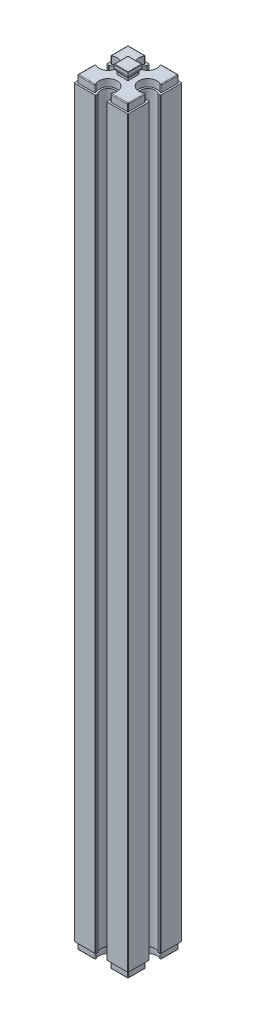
SolidWorks part; units mm, degrees
ref_plane "前视基准面" through (0, 0, 0) normal (0, 0, 1) x (1, 0, 0)
ref_plane "上视基准面" through (0, 0, 0) normal (0, 1, 0) x (1, 0, 0)
ref_plane "右视基准面" through (0, 0, 0) normal (1, 0, 0) x (0, 0, -1)
sketch "草图1" plane through (0, 0, 0) normal (0, 1, 0) x (1, 0, 0)
  line L0 (0, 0) -> (0, 7.5) construction
  line L1 (0, 0) -> (7.5, 0) construction
  line L2 (-7.5, 7.5) -> (-1.5, 7.5)
  line L3 (7.5, 7.5) -> (7.5, 1.5)
  line L4 (6.8229, 1.5) -> (7.5, 1.5)
  line L5 (6.8229, -1.5) -> (7.5, -1.5)
  line L6 (0, 7.5) -> (0, 5.5) construction
  line L7 (-1.5, 6.8229) -> (-1.5, 7.5)
  line L8 (1.5, 6.8229) -> (1.5, 7.5)
  line L9 (1.5, 7.5) -> (7.5, 7.5)
  line L10 (7.5, -1.5) -> (7.5, -7.5)
  line L11 (7.5, -7.5) -> (1.5, -7.5)
  line L12 (1.5, -6.8229) -> (1.5, -7.5)
  line L13 (-1.5, -6.8229) -> (-1.5, -7.5)
  line L14 (-1.5, -7.5) -> (-7.5, -7.5)
  line L15 (-7.5, -7.5) -> (-7.5, -1.5)
  line L16 (-6.8229, -1.5) -> (-7.5, -1.5)
  line L17 (-6.8229, 1.5) -> (-7.5, 1.5)
  line L18 (-7.5, 1.5) -> (-7.5, 7.5)
  arc A0 (-1.5, 6.8229) -> (1.5, 6.8229) centre (0, 5.5) ccw
  arc A1 (6.8229, 1.5) -> (6.8229, -1.5) centre (5.5, 0) ccw
  arc A2 (1.5, -6.8229) -> (-1.5, -6.8229) centre (0, -5.5) ccw
  arc A3 (-6.8229, -1.5) -> (-6.8229, 1.5) centre (-5.5, 0) ccw
  point P36 (0, 0)
  dimension "D6" = 4
  dimension "D7" = 2
  dimension "D1" = 7.5
  dimension "D2" = 7.5
  dimension "D3" = 2
  dimension "D4" = 7.5
  dimension "D5" = 1.5
extrude "凸台-拉伸1" add sketch "草图1" along normal blind 103
sketch "草图2" plane through (0, 103, 0) normal (0, 1, 0) x (1, 0, 0)
  line L0 (-7, 7) -> (-7, 2)
  line L1 (-7, 2) -> (-7, 2)
  line L2 (-7, -2) -> (-7, -2)
  line L3 (-7, -2) -> (-7, -7)
  line L4 (-7, -7) -> (-2, -7)
  line L5 (-2, -7) -> (-2, -7)
  line L6 (2, -7) -> (2, -7)
  line L7 (2, -7) -> (7, -7)
  line L8 (7, -7) -> (7, -2)
  line L9 (7, -2) -> (7, -2)
  line L10 (7, 2) -> (7, 2)
  line L11 (7, 2) -> (7, 7)
  line L12 (7, 7) -> (2, 7)
  line L13 (2, 7) -> (2, 7)
  line L14 (-2, 7) -> (-2, 7)
  line L15 (-2, 7) -> (-7, 7)
  line L16 (-7.5, 7.5) -> (-7.5, 1.5)
  line L17 (-7.5, 1.5) -> (-6.8229, 1.5)
  line L18 (-6.8229, -1.5) -> (-7.5, -1.5)
  line L19 (-7.5, -1.5) -> (-7.5, -7.5)
  line L20 (-7.5, -7.5) -> (-1.5, -7.5)
  line L21 (-1.5, -7.5) -> (-1.5, -6.8229)
  line L22 (1.5, -6.8229) -> (1.5, -7.5)
  line L23 (1.5, -7.5) -> (7.5, -7.5)
  line L24 (7.5, -7.5) -> (7.5, -1.5)
  line L25 (7.5, -1.5) -> (6.8229, -1.5)
  line L26 (6.8229, 1.5) -> (7.5, 1.5)
  line L27 (7.5, 1.5) -> (7.5, 7.5)
  line L28 (7.5, 7.5) -> (1.5, 7.5)
  line L29 (1.5, 7.5) -> (1.5, 6.8229)
  line L30 (-1.5, 6.8229) -> (-1.5, 7.5)
  line L31 (-1.5, 7.5) -> (-7.5, 7.5)
  line L32 (-7.5, 7.5) -> (-7.5, 1.5) construction
  line L33 (-7.5, 1.5) -> (-6.8229, 1.5) construction
  line L34 (-6.8229, -1.5) -> (-7.5, -1.5) construction
  line L35 (-7.5, -1.5) -> (-7.5, -7.5) construction
  line L36 (-7.5, -7.5) -> (-1.5, -7.5) construction
  line L37 (-1.5, -7.5) -> (-1.5, -6.8229) construction
  line L38 (1.5, -6.8229) -> (1.5, -7.5) construction
  line L39 (1.5, -7.5) -> (7.5, -7.5) construction
  line L40 (7.5, -7.5) -> (7.5, -1.5) construction
  line L41 (7.5, -1.5) -> (6.8229, -1.5) construction
  line L42 (6.8229, 1.5) -> (7.5, 1.5) construction
  line L43 (7.5, 1.5) -> (7.5, 7.5) construction
  line L44 (7.5, 7.5) -> (1.5, 7.5) construction
  line L45 (1.5, 7.5) -> (1.5, 6.8229) construction
  line L46 (-1.5, 6.8229) -> (-1.5, 7.5) construction
  line L47 (-1.5, 7.5) -> (-7.5, 7.5) construction
  arc A0 (-7, -2) -> (-7, 2) centre (-5.5, 0) ccw
  arc A1 (2, -7) -> (-2, -7) centre (0, -5.5) ccw
  arc A2 (7, 2) -> (7, -2) centre (5.5, 0) ccw
  arc A3 (-2, 7) -> (2, 7) centre (0, 5.5) ccw
  arc A4 (-6.8229, -1.5) -> (-6.8229, 1.5) centre (-5.5, 0) ccw
  arc A5 (1.5, -6.8229) -> (-1.5, -6.8229) centre (0, -5.5) ccw
  arc A6 (6.8229, 1.5) -> (6.8229, -1.5) centre (5.5, 0) ccw
  arc A7 (-1.5, 6.8229) -> (1.5, 6.8229) centre (0, 5.5) ccw
  arc A8 (-6.8229, -1.5) -> (-6.8229, 1.5) centre (-5.5, 0) ccw construction
  arc A9 (1.5, -6.8229) -> (-1.5, -6.8229) centre (0, -5.5) ccw construction
  arc A10 (6.8229, 1.5) -> (6.8229, -1.5) centre (5.5, 0) ccw construction
  arc A11 (-1.5, 6.8229) -> (1.5, 6.8229) centre (0, 5.5) ccw construction
  dimension "D1" = 0
  dimension "D2" = 0.5
extrude "凸台-拉伸2" add sketch "草图2" along normal blind 2
sketch "草图3" plane through (0, 0, 0) normal (1, 0, 0) x (0, 0, -1)
  line L0 (0, 105) -> (0, 107) construction
  line L1 (2.5, 105) -> (-2.5, 105) construction
  line L2 (0, 107) -> (0, 107.5) construction
  line L3 (-1.5, 105) -> (1.5, 105)
  line L4 (1.5, 105) -> (1.5, 105.6771)
  line L5 (-1.95, 107.5) -> (1.95, 107.5)
  line L6 (1.95, 107.5) -> (1.95, 106.5556)
  line L7 (-1.5, 105) -> (-1.5, 105.6771)
  line L8 (-1.95, 107.5) -> (-1.95, 106.5556)
  arc A0 (-1.5, 105.6771) -> (-1.95, 106.5556) centre (0, 107) cw
  arc A1 (1.5, 105.6771) -> (1.95, 106.5556) centre (0, 107) ccw
  dimension "D5" = 2
  dimension "D1" = 2
  dimension "D2" = 0.5
  dimension "D3" = 1.5
  dimension "D4" = 1.95
extrude "凸台-拉伸3" add sketch "草图3" along normal blind 2 and the other way blind 2
sketch "草图4" plane through (0, 0, 0) normal (0, 0, 1) x (1, 0, 0)
  line L0 (0, 105) -> (0, 107) construction
  line L1 (-2, 105) -> (2, 105) construction
  line L2 (0, 107) -> (0, 107.5) construction
  line L4 (1.5, 105) -> (1.5, 105.6771)
  line L5 (-1.5, 105) -> (-1.5, 105.6771)
  line L6 (1.95, 107.5) -> (1.95, 106.5556)
  line L7 (-1.95, 107.5) -> (-1.95, 106.5556)
  line L8 (-7, 105) -> (-2, 105) construction
  line L9 (-1.95, 107.5) -> (-2.5, 107.5)
  line L10 (1.5, 105) -> (2.5, 105)
  line L11 (-1.5, 105) -> (-2.5, 105)
  line L12 (-2.5, 107.5) -> (-2.5, 105)
  line L13 (2.5, 107.5) -> (2.5, 105)
  line L14 (1.95, 107.5) -> (2.5, 107.5)
  arc A0 (1.5, 105.6771) -> (1.95, 106.5556) centre (0, 107) ccw
  arc A1 (-1.5, 105.6771) -> (-1.95, 106.5556) centre (0, 107) cw
  dimension "D5" = 2
  dimension "D1" = 2
  dimension "D2" = 0.5
  dimension "D3" = 1.5
  dimension "D4" = 1.95
  dimension "D6" = 2.5
extrude "切除-拉伸1" cut sketch "草图4" against normal blind 2.5 and the other way blind 2.5
mirror "镜向1" about plane through (0, 0, 0) normal (0, 1, 0) of "切除-拉伸1", "凸台-拉伸3", "凸台-拉伸2", "凸台-拉伸1"
fillet "圆角1" radius 0.1 8 edges at (0, 107.5, -1.95) (1.95, 107.5, 0) (0, 107.5, 1.95) (-1.95, 107.5, 0) (0, -107.5, -1.95) (-1.95, -107.5, 0) (0, -107.5, 1.95) (1.95, -107.5, 0)
fillet "圆角2" radius 0.2 40 edges at (-4.5, -105, 7) (-2, -104, 7) (2, -104, 7) (4.5, -105, 7) (7, -104, 7) (7, -105, 4.5) (7, -104, 2) (7, -104, -2) (7, -105, -4.5) (7, -104, -7) (4.5, -105, -7) (2, -104, -7) (-2, -104, -7) (-4.5, -105, -7) (-7, -104, -7) (-7, -105, -4.5) (-7, -104, -2) (-7, -104, 2) (-7, -105, 4.5) (-7, -104, 7) (-7, 105, 4.5) (-7, 104, 2) (-7, 104, -2) (-7, 105, -4.5) (-7, 104, -7) (-4.5, 105, -7) (-2, 104, -7) (4.5, 105, -7) (2, 104, -7) (7, 104, -7) (7, 105, -4.5) (7, 104, -2) (7, 104, 2) (7, 105, 4.5) (7, 104, 7) (2, 104, 7) (-2, 104, 7) (4.5, 105, 7) (-4.5, 105, 7) (-7, 104, 7)
fillet "圆角3" radius 0.2 13 edges at (-1.5, 0, -7.5) (1.5, 0, -7.5) (7.5, 0, -7.5) (7.5, 0, -1.5) (7.5, 0, 1.5) (7.5, 0, 7.5) (-1.5, 0, 7.5) (1.5, 0, 7.5) (-6.8229, 0, -1.5) (-7.5, 0, 7.5) (-7.5, 0, 1.5) (-7.5, 0, -1.5) (-7.5, 0, -7.5)
